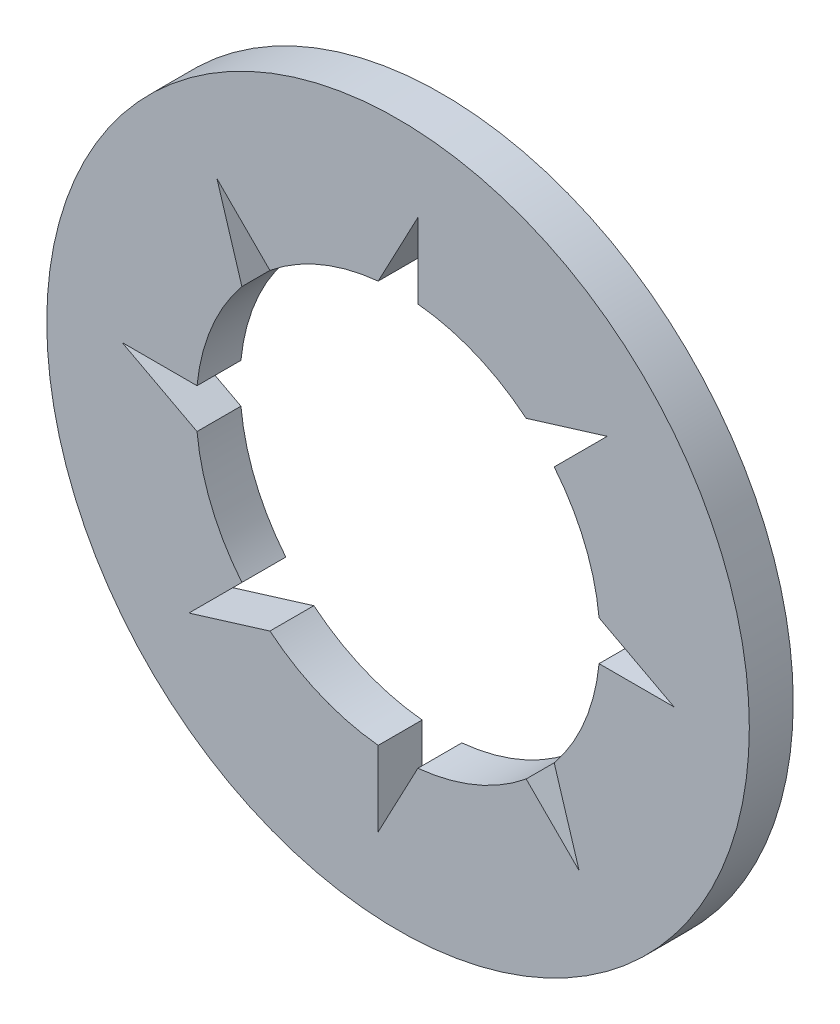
SolidWorks part; units mm, degrees
ref_plane "Front" through (0, 0, 0) normal (0, 0, 1) x (1, 0, 0)
ref_plane "Top" through (0, 0, 0) normal (0, 1, 0) x (1, 0, 0)
ref_plane "Right" through (0, 0, 0) normal (1, 0, 0) x (0, 0, -1)
sketch "Sketch1" plane through (0, 0, 0) normal (0, 0, 1) x (1, 0, 0)
  circle A0 centre (0, 0) radius 4
  circle A1 centre (0, 0) radius 2.3
  dimension "D0" = 8
  dimension "d" = 4.6
extrude "Base-Extrude" add sketch "Sketch1" against normal blind 0.5
sketch "Sketch2" plane through (-3.6497, 2.4196, 0) normal (0, 0, 1) x (1, 0, 0)
  line L0 (3.8755, -0.1307) -> (3.8755, 0.7223)
  line L1 (3.8755, 0.7223) -> (3.4239, -0.1307)
  line L2 (3.4239, -0.1307) -> (3.8755, -0.1307)
  line L3 (3.6497, -2.4196) -> (11.6497, -2.4196) construction
  circle A0 centre (3.6497, -2.4196) radius 3.15 construction
  circle A1 centre (3.6497, -2.4196) radius 2.3 construction
  circle A2 centre (3.6497, -2.4196) radius 4 construction
  dimension "D1" = 6.3
  dimension "D2" = 0.4516
  dimension "D3" = 8
extrude "TypeBSlot" cut sketch "Sketch2" against normal through all
pattern_circular "TypeBPattern" count 8 over 360 about axis through (0, 0, 0) along (0, 0, 1) of "TypeBSlot"
equation "\"D1@Sketch2\" = (  \"D0@Sketch1\" + \"d@Sketch1\" )  / 2"
equation "\"D2@Sketch2\" = \"d@Sketch1\" * 3.14159 / \"D3@Sketch2\" / 4"
